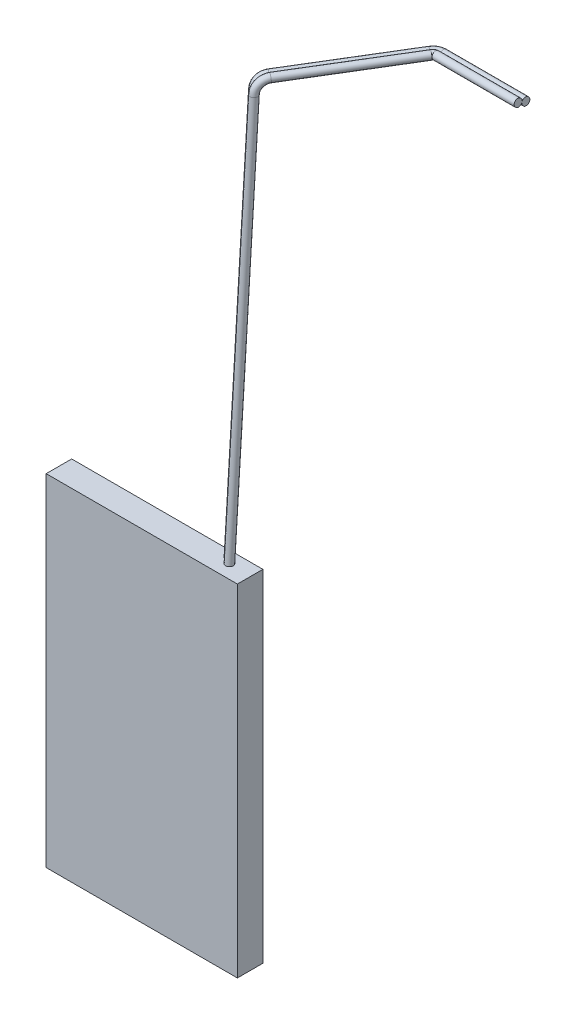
SolidWorks part; units mm, degrees
ref_plane "Front" through (0, 0, 0) normal (0, 0, 1) x (1, 0, 0)
ref_plane "Top" through (0, 0, 0) normal (0, 1, 0) x (1, 0, 0)
ref_plane "Right" through (0, 0, 0) normal (1, 0, 0) x (0, 0, -1)
sketch "Sketch1" plane through (0, 0, 0) normal (0, 0, 1) x (1, 0, 0)
  line L1 (-22.5, -40.15) -> (22.5, -40.15)
  line L2 (-22.5, -40.15) -> (-22.5, 40.15)
  line L3 (-22.5, 40.15) -> (22.5, 40.15)
  line L4 (22.5, -40.15) -> (22.5, 40.15)
  line L5 (-22.5, -40.15) -> (22.5, 40.15) construction
  line L6 (-22.5, 40.15) -> (22.5, -40.15) construction
  point P0 (0, 0)
  dimension "D1" = 45
  dimension "D2" = 80.3
extrude "Boss-Extrude1" add sketch "Sketch1" along normal mid plane 6
sketch "Sketch2" plane through (0, 40.15, 0) normal (0, 1, 0) x (1, 0, 0)
  line L0 (22.5, -3) -> (22.5, 3) construction
  line L1 (22.5, 3) -> (-22.5, 3) construction
  line L2 (16.15, 1.476) -> (17.4072, 0.2188) construction
  line L3 (16.15, 1.476) -> (16.15, 0.0775) construction
  line L4 (16.862, 0.9436) -> (16.8749, 0.9307)
  line L5 (16.6824, 0.764) -> (16.6953, 0.7511)
  arc A0 (16.6953, 0.7511) -> (16.8749, 0.9307) centre (17.4072, 0.2188) ccw
  arc A1 (16.862, 0.9436) -> (16.6824, 0.764) centre (16.15, 1.476) ccw
  dimension "D1" = 45
  dimension "D4" = 1.524
  dimension "D3" = 1.778
  dimension "D2" = 6.35
  dimension "D5" = 0.127
sketch3d "3DSketch1"
  line L0 (16.15, 40.15, -1.476) -> (14.8448, 131.562, -8.5509)
  line L1 (16.0551, 133.95, -10.7825) -> (30.3611, 133.95, -34.3129)
  line L2 (32.5314, 133.95, -35.5334) -> (51.8605, 133.95, -35.5334)
  line L3 (16.15, 40.15, -1.476) -> (16.15, 141.63, -1.476) construction
  line L4 (22.5, 40.15, -3) -> (-22.5, 40.15, -3) construction
  arc A0 (30.3611, 133.95, -34.3129) -> (32.5314, 133.95, -35.5334) centre (32.5314, 133.95, -32.9934) ccw
  arc A1 (14.8448, 131.562, -8.5509) -> (16.0551, 133.95, -10.7825) centre (16.1687, 131.4135, -10.7135) ccw
  circle A3 centre (36.81, 133.95, -27.8571) radius 9.125 construction
  point P9 (31.1031, 133.95, -35.5334)
  point P10 (32.5314, 131.41, -32.9934)
  point P13 (14.8107, 133.95, -8.7357)
  point P14 (14.0013, 131.2805, -12.0312)
  point P17 (36.81, 143.075, -27.8571)
  dimension "D1" = 2.54
  dimension "D2" = 4.5
sweep "Sweep1" add profiles "Sketch2" path "3DSketch1"
